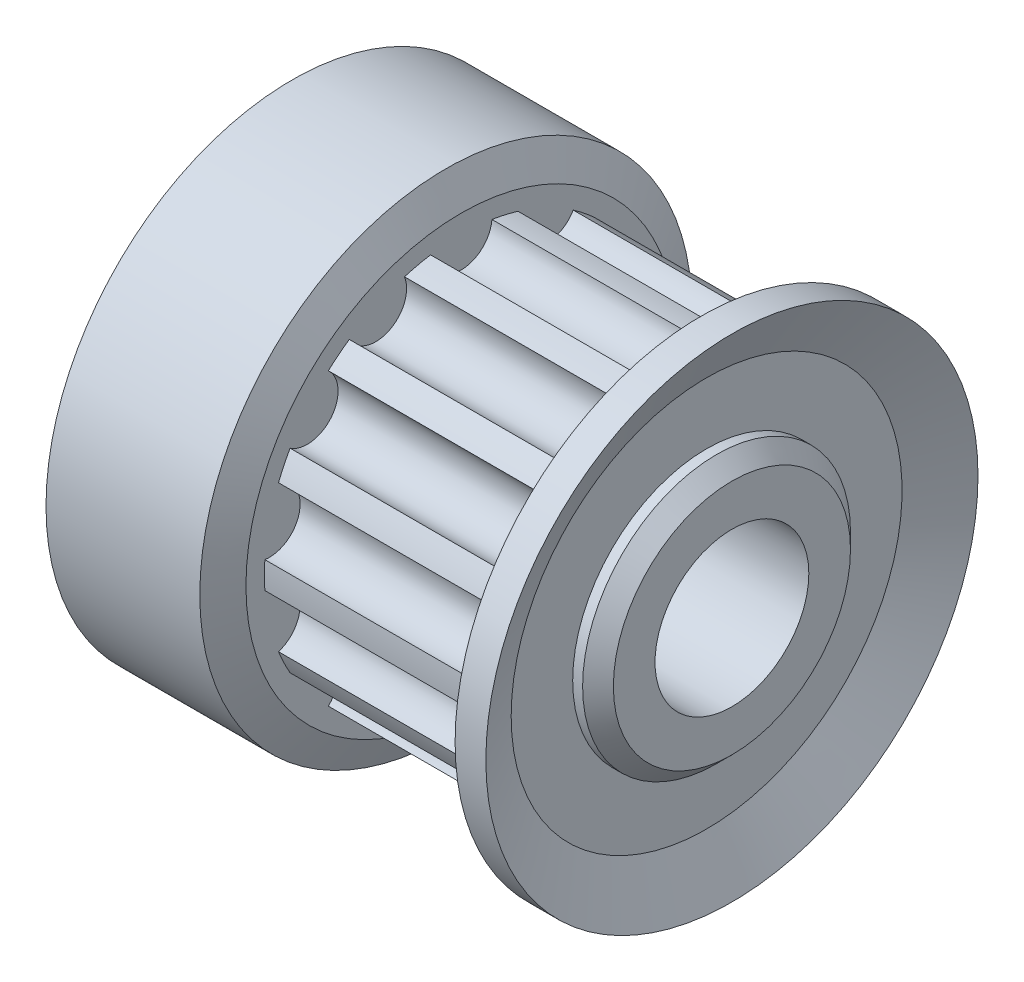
SolidWorks part; units mm, degrees
ref_plane "Front Plane" through (0, 0, 0) normal (0, 0, 1) x (1, 0, 0)
ref_plane "Top Plane" through (0, 0, 0) normal (0, 1, 0) x (1, 0, 0)
ref_plane "Right Plane" through (0, 0, 0) normal (1, 0, 0) x (0, 0, -1)
sketch "Sketch1" plane through (0, 0, 0) normal (0, 0, 1) x (1, 0, 0)
  line L0 (0, 7) -> (0, 0) construction
  line L1 (0, 0) -> (14.8, 0) construction
  line L2 (0, 7) -> (0, 3.9)
  line L3 (0.1, 3.8) -> (0.3, 3.8)
  line L4 (0.3, 3.8) -> (0, 3.5)
  line L5 (0, 3.5) -> (0, 0)
  line L6 (0, 0) -> (14.8, 0)
  line L7 (14.8, 0) -> (14.8, 3.8543)
  line L8 (14.3, 4.3543) -> (13.9771, 4.3543)
  line L9 (13.9771, 4.3543) -> (13.9771, 6.3543)
  line L10 (0, 7) -> (0.5, 8)
  line L11 (0.5, 8) -> (5.5, 8)
  line L12 (5.5, 8) -> (6, 7)
  line L13 (6, 7) -> (6, 6.4)
  line L14 (6, 6.4) -> (13, 6.4)
  line L15 (13.8, 8) -> (14.8, 8)
  line L16 (14.8, 8) -> (13.9771, 6.3543)
  line L17 (13, 6.4) -> (13.8, 8)
  line L18 (14.8, 3.8543) -> (14.3, 4.3543)
  arc A0 (0, 3.9) -> (0.1, 3.8) centre (0.1, 3.9) ccw
  point P8 (14.8, 4.3543)
  point P21 (0, 3.8)
  dimension "D12" = 0.1
  dimension "D1" = 14.8
  dimension "D2" = 8
  dimension "D3" = 8
  dimension "D4" = 5
  dimension "D5" = 6
  dimension "D6" = 0.5
  dimension "D7" = 0.5
  dimension "D8" = 1
  dimension "D9" = 3.2
  dimension "D10" = 0.3
  dimension "D11" = 0.3
  dimension "D13" = 7
  dimension "D14" = 14.8
  dimension "D15" = 1
  dimension "D16" = 1.84
  dimension "D17" = 2
revolve "Revolve1" add sketch "Sketch1" angle 360 about L6
sketch "Sketch2" plane through (14.8, 0, 0) normal (1, 0, 0) x (0, 0, -1)
  circle A0 centre (0, 0) radius 2.5
  dimension "D1" = 5
extrude "Cut-Extrude1" cut sketch "Sketch2" against normal through all
sketch "Sketch4" plane through (6, 0, 0) normal (1, 0, 0) x (0, 0, -1)
  line L0 (0, 0) -> (0, 6.4)
  circle A0 centre (0, 0) radius 6.4 construction
  circle A1 centre (0, 6.4) radius 1
  circle A2 centre (2.7769, 5.7662) radius 1
  circle A3 centre (5.0037, 3.9903) radius 1
  circle A4 centre (6.2395, 1.4241) radius 1
  circle A5 centre (6.2395, -1.4241) radius 1
  circle A6 centre (5.0037, -3.9903) radius 1
  circle A7 centre (2.7769, -5.7662) radius 1
  circle A8 centre (0, -6.4) radius 1
  circle A9 centre (-2.7769, -5.7662) radius 1
  circle A10 centre (-5.0037, -3.9903) radius 1
  circle A11 centre (-6.2395, -1.4241) radius 1
  circle A12 centre (-6.2395, 1.4241) radius 1
  circle A13 centre (-5.0037, 3.9903) radius 1
  circle A14 centre (-2.7769, 5.7662) radius 1
  point P34 (0, 0)
  dimension "D1" = 2
  dimension "D2" = 14
extrude "Cut-Extrude2" cut sketch "Sketch4" along normal blind 7 contours A13 | A14 | A2 | A1 | A3 | A12 | A11 | A10 | A9 | A8 | A7 | A6 | A5 | A4
sketch "Sketch5" plane through (0, 0, 0) normal (0, 0, 1) x (1, 0, 0)
  line L0 (0, 7) -> (0, -7) construction
  circle A0 centre (3, 0) radius 1.5
  dimension "D1" = 3
  dimension "D2" = 3
extrude "Cut-Extrude3" cut sketch "Sketch5" against normal through all
chamfer "Chamfer1" distance 0.2 angle 45 1 edges at (1.5336, -0.3156, -7.9938)
